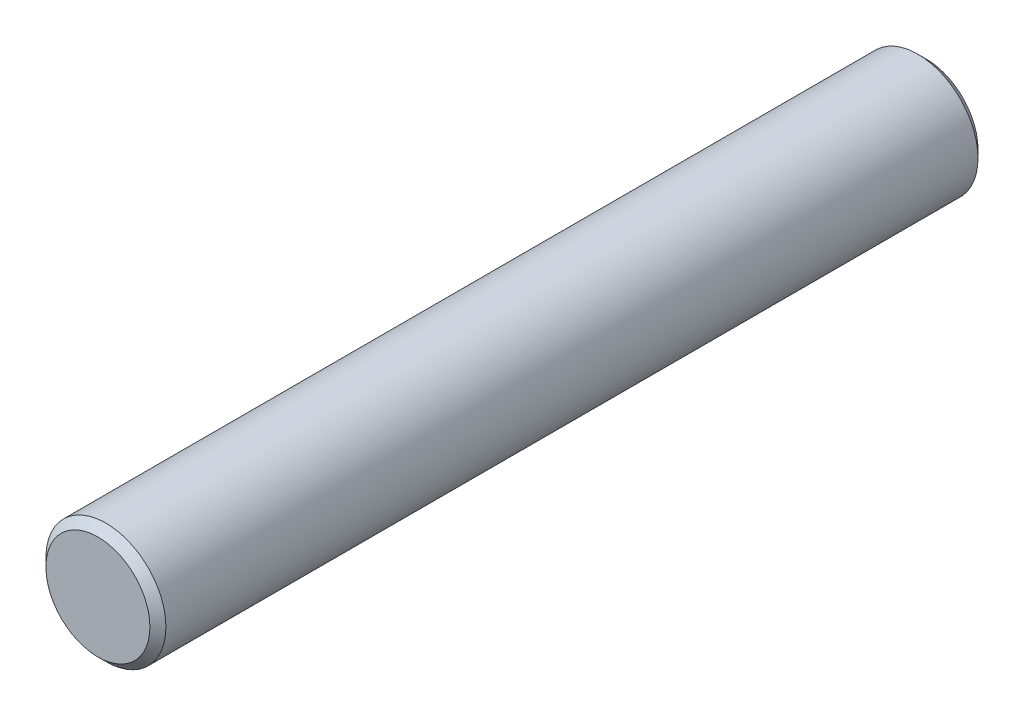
SolidWorks part; units mm, degrees
ref_plane "Plan de face" through (0, 0, 0) normal (0, 0, 1) x (1, 0, 0)
ref_plane "Plan de dessus" through (0, 0, 0) normal (0, 1, 0) x (1, 0, 0)
ref_plane "Plan de droite" through (0, 0, 0) normal (1, 0, 0) x (0, 0, -1)
sketch "Esquisse1" plane through (0, 0, 0) normal (0, 0, 1) x (1, 0, 0)
  circle A0 centre (0, 0) radius 1.5
  dimension "D1" = 3
extrude "Extrusion1" add sketch "Esquisse1" along normal blind 20.7
chamfer "Chanfrein1" distance 0.2 angle 45 2 edges at (1.5, 0, 0) (1.5, 0, 20.7)
